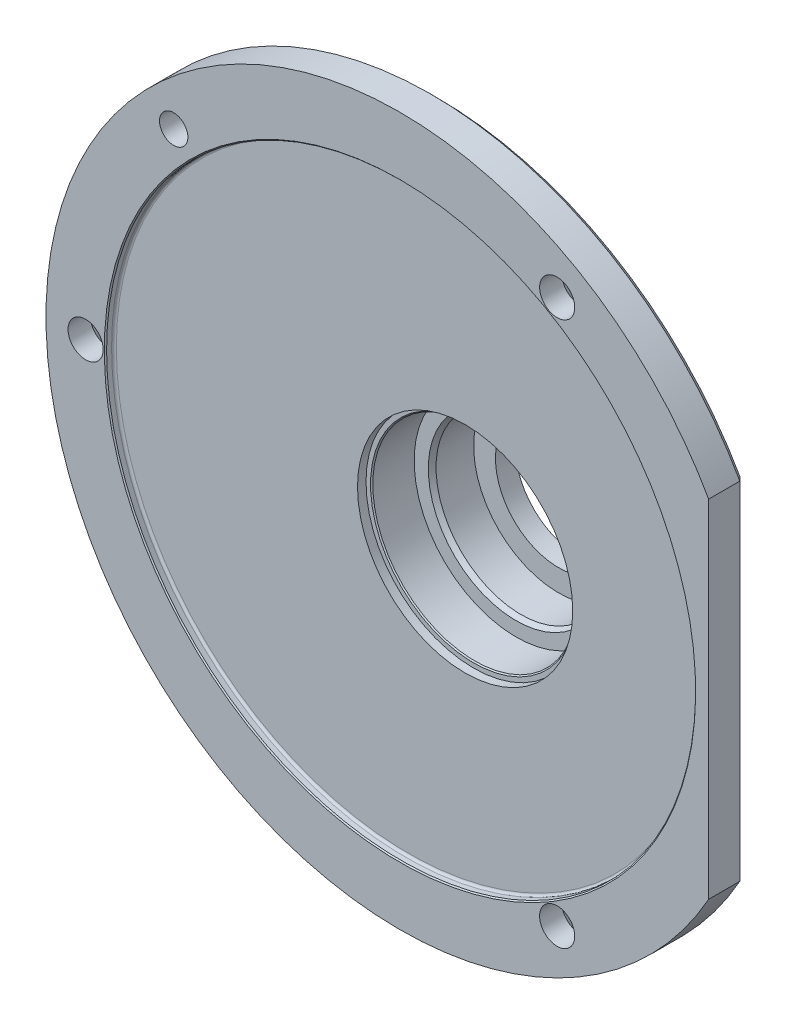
SolidWorks part; units mm, degrees
ref_plane "Plan de face" through (0, 0, 0) normal (0, 0, 1) x (1, 0, 0)
ref_plane "Plan de dessus" through (0, 0, 0) normal (0, 1, 0) x (1, 0, 0)
ref_plane "Plan de droite" through (0, 0, 0) normal (1, 0, 0) x (0, 0, -1)
sketch "Esquisse1" plane through (0, 0, 0) normal (0, 0, 1) x (1, 0, 0)
  circle A0 centre (0, 0) radius 62.5
  dimension "D1" = 125
extrude "Extrusion1" add sketch "Esquisse1" along normal blind 20
sketch "Esquisse2" plane through (0, 0, 20) normal (0, 0, 1) x (1, 0, 0)
  line L0 (0, 0) -> (10, 0) construction
  circle A0 centre (10, 0) radius 18
  dimension "D1" = 36
  dimension "D2" = 10
extrude "Enlèv. mat.-Extru.1" cut sketch "Esquisse2" against normal blind 9
sketch "Esquisse3" plane through (0, 0, 20) normal (0, 0, 1) x (1, 0, 0)
  circle A0 centre (10, 0) radius 11.1419
  circle A1 centre (10, 0) radius 18 construction
extrude "Enlèv. mat.-Extru.2" cut sketch "Esquisse3" against normal through all
sketch "Esquisse4" plane through (0, 0, 0) normal (0, 0, -1) x (-1, 0, 0)
  circle A0 centre (0, 0) radius 62.5 construction
  circle A1 centre (0, 0) radius 62.5
  circle A2 centre (-10, 0) radius 25
  circle A3 centre (-10, 0) radius 11.1419 construction
  dimension "D1" = 50
  dimension "D2" = 10
extrude "Enlèv. mat.-Extru.3" cut sketch "Esquisse4" against normal blind 15
sketch "Esquisse5" plane through (0, 0, 20) normal (0, 0, 1) x (1, 0, 0)
  circle A0 centre (10, 0) radius 19
  dimension "D1" = 38
extrude "Enlèv. mat.-Extru.4" cut sketch "Esquisse5" against normal blind 1.5
sketch "Esquisse6" plane through (0, 0, 20) normal (0, 0, 1) x (1, 0, 0)
  circle A0 centre (0, 0) radius 62.5 construction
  circle A1 centre (0, 0) radius 62.5
  circle A2 centre (0, 0) radius 52
  dimension "D1" = 104
extrude "Extrusion2" add sketch "Esquisse6" along normal blind 2
sketch "Esquisse7" plane through (0, 0, 15) normal (0, 0, -1) x (-1, 0, 0)
  line L0 (-54.5, 30.5941) -> (-54.5, -30.5941)
  circle A0 centre (0, 0) radius 62.5 construction
  arc A1 (-54.5, 30.5941) -> (-54.5, -30.5941) centre (0, 0) ccw
  dimension "D1" = 54.5
extrude "Enlèv. mat.-Extru.5" cut sketch "Esquisse7" against normal up to next
sketch "Esquisse8" plane through (0, 0, 15) normal (0, 0, -1) x (-1, 0, 0)
  circle A0 centre (55.5, 0) radius 3.1
  dimension "D1" = 6.2
  dimension "D2" = 55.5
extrude "Enlèv. mat.-Extru.6" cut sketch "Esquisse8" against normal up to next
chamfer "Chanfrein2" distance 2.55 angle 45 1 edges at (-58.6, 0, 15)
pattern_circular "Répétition circulaire1" count 3 over 360 about axis through (0, 0, 0) along (0, 0, 1) of "Chanfrein2", "Enlèv. mat.-Extru.6"
sketch "Esquisse9" plane through (54.5, 0, 0) normal (1, 0, 0) x (0, 0, -1)
  line L0 (-21.5, 62.5) -> (-21.5, -62.5)
  line L1 (-22, 62.5) -> (-22, -62.5) construction
  line L2 (-22, 62.5) -> (-22, -62.5)
  line L4 (-22, 62.5) -> (-21.5, 62.5)
  line L6 (-22, -62.5) -> (-21.5, -62.5)
  dimension "D1" = 0.5
extrude "Enlèv. mat.-Extru.7" cut sketch "Esquisse9" against normal through all
ref_plane "Plan1" through (0, 0, 0) normal (0.7071, 0.7071, 0) x (0, 0, -1)
sketch "Esquisse10" plane through (0, 0, 0) normal (0.7071, 0.7071, 0) x (0, 0, -1)
  line L0 (-35.8762, 56.5) -> (-1.7671, 56.5) construction
  line L1 (-21.5, 59) -> (-9.5, 59)
  line L2 (-9.5, 59) -> (-8.0566, 56.5)
  line L3 (-21.5, 62.5) -> (-21.5, -62.5) construction
  line L4 (-21.5, 59) -> (-21.5, 56.5)
  line L5 (-8.0566, 56.5) -> (-21.5, 56.5)
  dimension "D1" = 56.5
  dimension "D2" = 60
  dimension "D3" = 5
  dimension "D4" = 12
revolve "Enlèvement de matière-Révolution1" cut sketch "Esquisse10" angle 360 about L0
sketch "Esquisse11" plane through (0, 0, 15) normal (0, 0, -1) x (-1, 0, 0)
  line L0 (-10, 0) -> (55.5, 0) construction
  line L1 (-10, 0) -> (-27.75, 48.0644) construction
  line L2 (-10, 0) -> (-27.75, -48.0644) construction
  line L3 (-20.0595, 41.6726) -> (-13.7953, 24.7102)
  line L4 (14.4949, 5) -> (46.8397, 5)
  line L5 (-21.2219, 44.8204) -> (-7.3222, 7.1819) construction
  line L6 (14.4949, -5) -> (46.8397, -5)
  line L7 (-30.6027, 41.3561) -> (-16.703, 3.7177) construction
  line L8 (-20.0595, -41.6726) -> (-13.7953, -24.7102)
  line L9 (-29.4402, -38.2083) -> (-23.1761, -21.2459)
  line L10 (-29.4402, 38.2083) -> (-23.1761, 21.2459)
  line L11 (-22.148, -47.3279) -> (-11.4794, -18.4391) construction
  line L12 (-31.5287, -43.8637) -> (-20.8602, -14.9748) construction
  arc A0 (46.8397, 5) -> (46.8397, -5) centre (55.5, 0) ccw
  arc A1 (-29.4402, 38.2083) -> (-20.0595, 41.6726) centre (-27.75, 48.0644) ccw
  arc A2 (-20.0595, -41.6726) -> (-29.4402, -38.2083) centre (-27.75, -48.0644) ccw
  circle A3 centre (-10, 0) radius 25 construction
  arc A4 (-23.1761, -21.2459) -> (-13.7953, -24.7102) centre (-10, 0) ccw
  arc A5 (-13.7953, 24.7102) -> (-23.1761, 21.2459) centre (-10, 0) ccw
  arc A6 (14.4949, -5) -> (14.4949, 5) centre (-10, 0) ccw
  dimension "D1" = 20
  dimension "D2" = 20
  dimension "D3" = 20
  dimension "D4" = 5
  dimension "D5" = 10
  dimension "D6" = 5
  dimension "D7" = 5
  dimension "D8" = 10
  dimension "D9" = 10
extrude "Extrusion3" add sketch "Esquisse11" along normal up to surface (15 mm away)
fillet "Congé7" radius 5.5 6 edges at (13.7953, -24.7102, 7.5) (-14.4949, -5, 7.5) (-14.4949, 5, 7.5) (13.7953, 24.7102, 7.5) (23.1761, 21.2459, 7.5) (23.1761, -21.2459, 7.5)
sketch "Esquisse12" plane through (0, -5, 0) normal (0, -1, 0) x (1, 0, 0)
  line L3 (-46.8397, 0) -> (-18.6356, 0) construction
  line L5 (-46.8397, 0) -> (-13.5702, 0)
  line L6 (-46.8397, 0) -> (-46.8397, 15) construction
  line L7 (-46.8397, 0) -> (-46.8397, 15)
  line L8 (-13.5702, 0) -> (-46.8397, 15)
extrude "Enlèv. mat.-Extru.8" cut sketch "Esquisse12" against normal up to surface (10 mm away)
sketch "Esquisse13" plane through (4.1095, 1.5176, 0) normal (-0.9381, -0.3464, 0) x (0, 0, 1)
  line L0 (0, -32.0999) -> (0, -46.0412) construction
  line L1 (15, -46.0412) -> (0, -46.0412)
  line L2 (0, -27.0345) -> (0, -46.0412)
  line L3 (0, -27.0345) -> (15, -46.0412)
extrude "Enlèv. mat.-Extru.9" cut sketch "Esquisse13" against normal up to surface (10 mm away)
sketch "Esquisse14" plane through (13.4903, -4.9819, 0) normal (0.9381, -0.3464, 0) x (0, 0, -1)
  line L0 (0, 32.0999) -> (0, 46.0412) construction
  line L1 (-15, 46.0412) -> (0, 46.0412)
  line L2 (0, 27.0345) -> (0, 46.0412)
  line L6 (-15, 46.0412) -> (0, 27.0345)
extrude "Enlèv. mat.-Extru.10" cut sketch "Esquisse14" against normal up to surface (10 mm away)
fillet "Congé9" radius 5 15 edges at (17.6446, 35.1336, 15) (13.2093, 25.9836, 15) (-4.2913, 20.5124, 15) (-15.4864, 5.9909, 15) (-32.7377, 5, 15) (27.0254, 31.6693, 15) (24.4491, 21.8327, 15) (27.0254, -31.6693, 15) (24.4491, -21.8327, 15) (-32.7377, -5, 15) (-15.4864, -5.9909, 15) (-4.2913, -20.5124, 15) (13.2093, -25.9836, 15) (35, 0, 15) (17.6446, -35.1336, 15)
fillet "Congé10" radius 2 9 edges at (13.2093, -25.9836, 0) (-15.4864, -5.9909, 0) (-4.2913, -20.5124, 0) (-15.4864, 5.9909, 0) (13.2093, 25.9836, 0) (24.4491, 21.8327, 0) (24.4491, -21.8327, 0) (-4.2913, 20.5124, 0) (35, 0, 0)
sketch "Esquisse17" plane through (4.1095, -1.5176, 0) normal (0.9381, -0.3464, 0) x (0, 0, -1)
  line L2 (-3.9976, 32.0999) -> (-0.0001, 27.0347)
  line L3 (-2, 32.0999) -> (-3.9976, 32.0999)
  line L4 (-3.9976, 32.0999) -> (-0.0001, 27.0347)
  line L5 (-2, 32.0999) -> (-3.9976, 32.0999)
  spline S1 degree 3 poles (-2943.4044, -550.5763) (-84.5091, -29.4022) (5.3481, 7.8345) (-0.2591, 28.6201) (-0.331, 28.8411) (-0.4908, 29.2731) (-0.579, 29.4849) (-12.3869, 55.5983) (-118.2277, 34.0531) (2638.7281, 1454.16) knots -11.304076 -11.304076 -11.304076 -11.304076 0.25 0.25 0.375 0.375 0.5 0.5 16.016161 16.016161 16.016161 16.016161 only from (-0.0001, 27.0347) to (-2, 32.0999)
  spline S2 degree 3 poles (-0.0001, 27.0347) (-0.0037, 27.5) (-0.0791, 27.9527) (-0.2591, 28.6201) (-0.331, 28.8411) (-0.4908, 29.2731) (-0.579, 29.4849) (-1.0508, 30.5284) (-1.526, 31.3139) (-2, 32.0999) knots 0 0 0 0 0.25 0.25 0.375 0.375 0.5 0.5 1 1 1 1
  dimension "D1" = 0
extrude "Enlèv. mat.-Extru.12" cut sketch "Esquisse17" against normal through all
sketch "Esquisse18" plane through (13.4903, -4.9819, 0) normal (-0.9381, 0.3464, 0) x (0, 0, 1)
  line L2 (3.9976, 32.0999) -> (2, 32.0999)
  line L3 (0.0001, 27.0347) -> (3.9976, 32.0999)
  line L4 (3.9976, 32.0999) -> (2, 32.0999)
  line L5 (0.0001, 27.0347) -> (3.9976, 32.0999)
  spline S1 degree 3 poles (-2638.7612, 1454.1771) (118.2285, 34.0529) (12.3869, 55.5984) (0.579, 29.4849) (0.4908, 29.2731) (0.331, 28.8411) (0.2591, 28.6201) (-5.3481, 7.8347) (84.5074, -29.4015) (2943.3252, -550.5618) knots -15.016223 -15.016223 -15.016223 -15.016223 0.5 0.5 0.625 0.625 0.75 0.75 12.303969 12.303969 12.303969 12.303969 only from (2, 32.0999) to (0.0001, 27.0347)
  spline S2 degree 3 poles (2, 32.0999) (1.526, 31.3139) (1.0508, 30.5284) (0.579, 29.4849) (0.4908, 29.2731) (0.331, 28.8411) (0.2591, 28.6201) (0.0791, 27.9527) (0.0037, 27.5) (0.0001, 27.0347) knots 0 0 0 0 0.5 0.5 0.625 0.625 0.75 0.75 1 1 1 1
  dimension "D1" = 0
extrude "Enlèv. mat.-Extru.13" cut sketch "Esquisse18" against normal through all
sketch "Esquisse19" plane through (0, 5, 0) normal (0, -1, 0) x (1, 0, 0)
  line L2 (-18.6356, 2.2838) -> (-18.6356, 2)
  line L3 (-13.5705, 0.0001) -> (-18.6356, 2.2838)
  line L4 (-18.6356, 2.2838) -> (-18.6356, 2)
  line L5 (-13.5705, 0.0001) -> (-18.6356, 2.2838)
  spline S1 degree 3 poles (-1440.5617, -2638.7351) (-20.5908, 118.2247) (-42.1339, 12.387) (-16.0207, 0.579) (-15.8089, 0.4908) (-15.3769, 0.331) (-15.1559, 0.2592) (5.6297, -5.3484) (42.8687, 84.5058) (564.1168, 2943.3543) knots -15.016396 -15.016396 -15.016396 -15.016396 0.5 0.5 0.625 0.625 0.75 0.75 12.304409 12.304409 12.304409 12.304409 only from (-18.6356, 2) to (-13.5705, 0.0001)
  spline S2 degree 3 poles (-18.6356, 2) (-17.8496, 1.526) (-17.0641, 1.0508) (-16.0207, 0.579) (-15.8089, 0.4908) (-15.3769, 0.331) (-15.1559, 0.2592) (-14.4885, 0.0791) (-14.0358, 0.0038) (-13.5705, 0.0001) knots 0 0 0 0 0.5 0.5 0.625 0.625 0.75 0.75 1 1 1 1
  dimension "D1" = 0
extrude "Enlèv. mat.-Extru.14" cut sketch "Esquisse19" against normal through all
sketch "Esquisse20" plane through (0, -5, 0) normal (0, 1, 0) x (1, 0, 0)
  line L2 (-18.6356, -2.2838) -> (-13.5705, -0.0001)
  line L3 (-18.6356, -2) -> (-18.6356, -2.2838)
  line L4 (-18.6356, -2.2838) -> (-13.5705, -0.0001)
  line L5 (-18.6356, -2) -> (-18.6356, -2.2838)
  spline S1 degree 3 poles (564.1199, -2943.3712) (42.8688, -84.5062) (5.6297, 5.3484) (-15.1559, -0.2592) (-15.3769, -0.331) (-15.8089, -0.4908) (-16.0207, -0.579) (-42.134, -12.3871) (-20.5905, -118.2262) (-1440.592, 2638.7939) knots -11.304432 -11.304432 -11.304432 -11.304432 0.25 0.25 0.375 0.375 0.5 0.5 16.016506 16.016506 16.016506 16.016506 only from (-13.5705, -0.0001) to (-18.6356, -2)
  spline S2 degree 3 poles (-13.5705, -0.0001) (-14.0358, -0.0038) (-14.4885, -0.0791) (-15.1559, -0.2592) (-15.3769, -0.331) (-15.8089, -0.4908) (-16.0207, -0.579) (-17.0641, -1.0508) (-17.8496, -1.526) (-18.6356, -2) knots 0 0 0 0 0.25 0.25 0.375 0.375 0.5 0.5 1 1 1 1
  dimension "D1" = 0
extrude "Enlèv. mat.-Extru.15" cut sketch "Esquisse20" against normal through all
sketch "Esquisse21" plane through (4.1095, 1.5176, 0) normal (0.9381, 0.3464, 0) x (0, 0, -1)
  line L2 (-3.9976, -32.0999) -> (-2, -32.0999)
  line L3 (-0.0001, -27.0347) -> (-3.9976, -32.0999)
  line L4 (-3.9976, -32.0999) -> (-2, -32.0999)
  line L5 (-0.0001, -27.0347) -> (-3.9976, -32.0999)
  spline S1 degree 3 poles (2638.7612, -1454.1771) (-118.2285, -34.0529) (-12.3869, -55.5984) (-0.579, -29.4849) (-0.4908, -29.2731) (-0.331, -28.8411) (-0.2591, -28.6201) (5.3481, -7.8347) (-84.5074, 29.4015) (-2943.3252, 550.5618) knots -15.016223 -15.016223 -15.016223 -15.016223 0.5 0.5 0.625 0.625 0.75 0.75 12.303969 12.303969 12.303969 12.303969 only from (-2, -32.0999) to (-0.0001, -27.0347)
  spline S2 degree 3 poles (-2, -32.0999) (-1.526, -31.3139) (-1.0508, -30.5284) (-0.579, -29.4849) (-0.4908, -29.2731) (-0.331, -28.8411) (-0.2591, -28.6201) (-0.0791, -27.9527) (-0.0037, -27.5) (-0.0001, -27.0347) knots 0 0 0 0 0.5 0.5 0.625 0.625 0.75 0.75 1 1 1 1
  dimension "D1" = 0
extrude "Enlèv. mat.-Extru.16" cut sketch "Esquisse21" against normal through all
sketch "Esquisse22" plane through (13.4903, 4.9819, 0) normal (-0.9381, -0.3464, 0) x (0, 0, 1)
  line L2 (3.9976, -32.0999) -> (0.0001, -27.0347)
  line L3 (2, -32.0999) -> (3.9976, -32.0999)
  line L4 (3.9976, -32.0999) -> (0.0001, -27.0347)
  line L5 (2, -32.0999) -> (3.9976, -32.0999)
  spline S1 degree 3 poles (2943.4044, 550.5763) (84.5091, 29.4022) (-5.3481, -7.8345) (0.2591, -28.6201) (0.331, -28.8411) (0.4908, -29.2731) (0.579, -29.4849) (12.3869, -55.5983) (118.2277, -34.0531) (-2638.7281, -1454.16) knots -11.304076 -11.304076 -11.304076 -11.304076 0.25 0.25 0.375 0.375 0.5 0.5 16.016161 16.016161 16.016161 16.016161 only from (0.0001, -27.0347) to (2, -32.0999)
  spline S2 degree 3 poles (0.0001, -27.0347) (0.0037, -27.5) (0.0791, -27.9527) (0.2591, -28.6201) (0.331, -28.8411) (0.4908, -29.2731) (0.579, -29.4849) (1.0508, -30.5284) (1.526, -31.3139) (2, -32.0999) knots 0 0 0 0 0.25 0.25 0.375 0.375 0.5 0.5 1 1 1 1
  dimension "D1" = 0
extrude "Enlèv. mat.-Extru.17" cut sketch "Esquisse22" against normal through all
chamfer "Chanfrein3" distance 1 angle 45 1 edges at (-62.5, 0, 15)
sketch "Esquisse15" plane through (0, 0, 11) normal (0, 0, 1) x (1, 0, 0)
  circle A0 centre (10, 0) radius 15
  dimension "D1" = 30
extrude "Enlèv. mat.-Extru.11" cut sketch "Esquisse15" against normal blind 7.5
fillet "Congé5" radius 0.42 1 edges at (52, 0, 20)
chamfer "Chanfrein4" distance 0.2 angle 45 1 edges at (0, 52, 21.5)
chamfer "Chanfrein5" distance 1 angle 45 1 edges at (54.5, 0, 15)
sketch "Esquisse  ebauche balayage 1" [suppressed] plane through (3.5944, -9.7331, -13.1471) normal (0.2146, -0.5811, -0.785) x (-0.9767, -0.1277, -0.1725)
  line L0 (-21.5176, -22.5763) -> (-24.2152, -31.8821) construction
  line L1 (-19.7209, -16.3786) -> (-26.4624, -39.6338)
  line L3 (-24.5232, -14.9864) -> (-31.2647, -38.2417)
  line L5 (-14.9186, -17.7707) -> (-21.6601, -41.026)
  line L6 (-10.1163, -19.1629) -> (-16.8579, -42.4181)
  line L7 (-5.314, -20.555) -> (-12.0556, -43.8103)
  dimension "D1" = 5
  dimension "D2" = 10
  dimension "D3" = 5
sketch "Esquisse ebauche balayage 2" [suppressed] plane through (-2.2925, 0, -5.0847) normal (-0.411, 0, -0.9116) x (-0.9116, 0, 0.411)
  line L0 (17.9274, -5) -> (36.7008, -5) construction
  line L1 (12.371, -5) -> (48.8657, -5)
  line L3 (12.371, -10) -> (48.8657, -10)
  line L5 (12.371, 0) -> (48.8657, 0)
  line L6 (12.371, -5) -> (48.8657, -5)
  line L7 (12.371, 5) -> (48.8657, 5)
  line L8 (12.371, 0) -> (48.8657, 0)
  line L9 (12.371, 10) -> (48.8657, 10)
  line L10 (12.371, 5) -> (48.8657, 5)
  dimension "D1" = 5
sketch "Esquisse ebauche balayage 3" [suppressed] plane through (3.5944, 9.7331, -13.1471) normal (0.2146, 0.5811, -0.785) x (-0.9767, 0.1277, -0.1725)
  line L0 (-11.913, 25.3606) -> (-14.6107, 34.6664) construction
  line L1 (-10.1163, 19.1629) -> (-16.8579, 42.4181)
  line L3 (-5.314, 20.555) -> (-12.0556, 43.8103)
  line L5 (-14.9186, 17.7707) -> (-21.6601, 41.026)
  line L6 (-10.1163, 19.1629) -> (-16.8579, 42.4181)
  line L7 (-19.7209, 16.3786) -> (-26.4624, 39.6338)
  line L8 (-14.9186, 17.7707) -> (-21.6601, 41.026)
  line L9 (-24.5232, 14.9864) -> (-31.2647, 38.2417)
  line L10 (-19.7209, 16.3786) -> (-26.4624, 39.6338)
  dimension "D1" = 5
sketch "Esquisse finition balayage" [suppressed] plane through (-2.2925, 0, -5.0847) normal (-0.411, 0, -0.9116) x (-0.9116, 0, 0.411)
  line L0 (17.9274, -5) -> (36.7008, -5) construction
  line L1 (12.371, -5) -> (48.8657, -5)
  line L3 (12.371, -5.5) -> (48.8657, -5.5)
  line L5 (12.371, -6) -> (48.8657, -6)
  line L6 (12.371, -6.5) -> (48.8657, -6.5)
  line L7 (12.371, -7) -> (48.8657, -7)
  line L8 (12.371, -7.5) -> (48.8657, -7.5)
  line L9 (12.371, -8) -> (48.8657, -8)
  line L10 (12.371, -8.5) -> (48.8657, -8.5)
  line L11 (12.371, -9) -> (48.8657, -9)
  line L12 (12.371, -9.5) -> (48.8657, -9.5)
  line L13 (12.371, 0) -> (48.8657, 0)
  line L14 (12.371, -0.5) -> (48.8657, -0.5)
  line L15 (12.371, -1) -> (48.8657, -1)
  line L16 (12.371, -1.5) -> (48.8657, -1.5)
  line L17 (12.371, -2) -> (48.8657, -2)
  line L18 (12.371, -2.5) -> (48.8657, -2.5)
  line L19 (12.371, -3) -> (48.8657, -3)
  line L20 (12.371, -3.5) -> (48.8657, -3.5)
  line L21 (12.371, -4) -> (48.8657, -4)
  line L22 (12.371, -4.5) -> (48.8657, -4.5)
  line L23 (12.371, 5) -> (48.8657, 5)
  line L24 (12.371, 4.5) -> (48.8657, 4.5)
  line L25 (12.371, 4) -> (48.8657, 4)
  line L26 (12.371, 3.5) -> (48.8657, 3.5)
  line L27 (12.371, 3) -> (48.8657, 3)
  line L28 (12.371, 2.5) -> (48.8657, 2.5)
  line L29 (12.371, 2) -> (48.8657, 2)
  line L30 (12.371, 1.5) -> (48.8657, 1.5)
  line L31 (12.371, 1) -> (48.8657, 1)
  line L32 (12.371, 0.5) -> (48.8657, 0.5)
  line L33 (12.371, 10) -> (48.8657, 10)
  line L34 (12.371, 9.5) -> (48.8657, 9.5)
  line L35 (12.371, 9) -> (48.8657, 9)
  line L36 (12.371, 8.5) -> (48.8657, 8.5)
  line L37 (12.371, 8) -> (48.8657, 8)
  line L38 (12.371, 7.5) -> (48.8657, 7.5)
  line L39 (12.371, 7) -> (48.8657, 7)
  line L40 (12.371, 6.5) -> (48.8657, 6.5)
  line L41 (12.371, 6) -> (48.8657, 6)
  line L42 (12.371, 5.5) -> (48.8657, 5.5)
sketch "Esquisse finition balayage  1" [suppressed] plane through (3.5944, -9.7331, -13.1471) normal (0.2146, -0.5811, -0.785) x (-0.9767, -0.1277, -0.1725)
  line L0 (-21.5176, -22.5763) -> (-24.2152, -31.8821) construction
  line L1 (-19.7209, -16.3786) -> (-26.4624, -39.6338)
  line L3 (-20.2011, -16.2394) -> (-26.9427, -39.4946)
  line L5 (-20.6813, -16.1001) -> (-27.4229, -39.3554)
  line L6 (-21.1616, -15.9609) -> (-27.9031, -39.2162)
  line L7 (-21.6418, -15.8217) -> (-28.3833, -39.077)
  line L8 (-22.122, -15.6825) -> (-28.8636, -38.9378)
  line L9 (-22.6023, -15.5433) -> (-29.3438, -38.7985)
  line L10 (-23.0825, -15.4041) -> (-29.824, -38.6593)
  line L11 (-23.5627, -15.2649) -> (-30.3043, -38.5201)
  line L12 (-24.0429, -15.1256) -> (-30.7845, -38.3809)
  line L13 (-14.9186, -17.7707) -> (-21.6601, -41.026)
  line L14 (-15.3988, -17.6315) -> (-22.1404, -40.8868)
  line L15 (-15.8791, -17.4923) -> (-22.6206, -40.7475)
  line L16 (-16.3593, -17.3531) -> (-23.1008, -40.6083)
  line L17 (-16.8395, -17.2139) -> (-23.5811, -40.4691)
  line L18 (-17.3197, -17.0746) -> (-24.0613, -40.3299)
  line L19 (-17.8, -16.9354) -> (-24.5415, -40.1907)
  line L20 (-18.2802, -16.7962) -> (-25.0217, -40.0515)
  line L21 (-18.7604, -16.657) -> (-25.502, -39.9123)
  line L22 (-19.2407, -16.5178) -> (-25.9822, -39.773)
  line L23 (-10.1163, -19.1629) -> (-16.8579, -42.4181)
  line L24 (-10.5965, -19.0237) -> (-17.3381, -42.2789)
  line L25 (-11.0768, -18.8844) -> (-17.8183, -42.1397)
  line L26 (-11.557, -18.7452) -> (-18.2986, -42.0005)
  line L27 (-12.0372, -18.606) -> (-18.7788, -41.8613)
  line L28 (-12.5175, -18.4668) -> (-19.259, -41.7221)
  line L29 (-12.9977, -18.3276) -> (-19.7392, -41.5828)
  line L30 (-13.4779, -18.1884) -> (-20.2195, -41.4436)
  line L31 (-13.9581, -18.0492) -> (-20.6997, -41.3044)
  line L32 (-14.4384, -17.9099) -> (-21.1799, -41.1652)
  line L33 (-5.314, -20.555) -> (-12.0556, -43.8103)
  line L34 (-5.7943, -20.4158) -> (-12.5358, -43.6711)
  line L35 (-6.2745, -20.2766) -> (-13.016, -43.5318)
  line L36 (-6.7547, -20.1374) -> (-13.4963, -43.3926)
  line L37 (-7.235, -19.9982) -> (-13.9765, -43.2534)
  line L38 (-7.7152, -19.859) -> (-14.4567, -43.1142)
  line L39 (-8.1954, -19.7197) -> (-14.937, -42.975)
  line L40 (-8.6756, -19.5805) -> (-15.4172, -42.8358)
  line L41 (-9.1559, -19.4413) -> (-15.8974, -42.6966)
  line L42 (-9.6361, -19.3021) -> (-16.3776, -42.5573)
sketch "Esquisse finition balayage 3" [suppressed] plane through (3.5944, 9.7331, -13.1471) normal (0.2146, 0.5811, -0.785) x (-0.9767, 0.1277, -0.1725)
  line L0 (-11.913, 25.3606) -> (-14.6107, 34.6664) construction
  line L1 (-10.1163, 19.1629) -> (-16.8579, 42.4181)
  line L3 (-9.6361, 19.3021) -> (-16.3776, 42.5573)
  line L5 (-9.1559, 19.4413) -> (-15.8974, 42.6966)
  line L6 (-9.0893, 15.1636) -> (-8.9867, 15.2662)
  line L7 (-8.6756, 19.5805) -> (-15.4172, 42.8358)
  line L8 (-8.1954, 19.7197) -> (-14.937, 42.975)
  line L9 (-7.7152, 19.859) -> (-14.4567, 43.1142)
  line L10 (-7.235, 19.9982) -> (-13.9765, 43.2534)
  line L11 (-6.7547, 20.1374) -> (-13.4963, 43.3926)
  line L12 (-6.2745, 20.2766) -> (-13.016, 43.5318)
  line L13 (-5.7943, 20.4158) -> (-12.5358, 43.6711)
  line L14 (-14.9186, 17.7707) -> (-21.6601, 41.026)
  line L15 (-14.4384, 17.9099) -> (-21.1799, 41.1652)
  line L16 (-13.9581, 18.0492) -> (-20.6997, 41.3044)
  line L17 (-13.4779, 18.1884) -> (-20.2195, 41.4436)
  line L18 (-12.9977, 18.3276) -> (-19.7392, 41.5828)
  line L19 (-12.5175, 18.4668) -> (-19.259, 41.7221)
  line L20 (-12.0372, 18.606) -> (-18.7788, 41.8613)
  line L21 (-11.557, 18.7452) -> (-18.2986, 42.0005)
  line L22 (-11.0768, 18.8844) -> (-17.8183, 42.1397)
  line L23 (-10.5965, 19.0237) -> (-17.3381, 42.2789)
  line L24 (-19.7209, 16.3786) -> (-26.4624, 39.6338)
  line L25 (-19.2407, 16.5178) -> (-25.9822, 39.773)
  line L26 (-18.7604, 16.657) -> (-25.502, 39.9123)
  line L27 (-18.2802, 16.7962) -> (-25.0217, 40.0515)
  line L28 (-17.8, 16.9354) -> (-24.5415, 40.1907)
  line L29 (-17.3197, 17.0746) -> (-24.0613, 40.3299)
  line L30 (-16.8395, 17.2139) -> (-23.5811, 40.4691)
  line L31 (-16.3593, 17.3531) -> (-23.1008, 40.6083)
  line L32 (-15.8791, 17.4923) -> (-22.6206, 40.7475)
  line L33 (-15.3988, 17.6315) -> (-22.1404, 40.8868)
  line L34 (-24.5232, 14.9864) -> (-31.2647, 38.2417)
  line L35 (-24.0429, 15.1256) -> (-30.7845, 38.3809)
  line L36 (-23.5627, 15.2649) -> (-30.3043, 38.5201)
  line L37 (-23.0825, 15.4041) -> (-29.824, 38.6593)
  line L38 (-22.6023, 15.5433) -> (-29.3438, 38.7985)
  line L39 (-22.122, 15.6825) -> (-28.8636, 38.9378)
  line L40 (-21.6418, 15.8217) -> (-28.3833, 39.077)
  line L41 (-21.1616, 15.9609) -> (-27.9031, 39.2162)
  line L42 (-20.6813, 16.1001) -> (-27.4229, 39.3554)
  line L43 (-20.2011, 16.2394) -> (-26.9427, 39.4946)
sketch "Esquisse23" plane through (0, 0, 0) normal (0, 0, -1) x (-1, 0, 0)
  line L0 (2, -12) -> (9.6828, -3.7671)
  line L1 (2, -12) -> (2.5843, -0.9256)
  line L2 (4.5, 9) -> (1, 18.7222)
  line L3 (4.5, 9) -> (-4, 13)
  line L4 (2.5843, -0.9256) -> (4.0233, -5)
  line L5 (9.6828, -3.7671) -> (5.9598, -5.5)
  arc A2 (-4, 13) -> (4.0233, -5) centre (-12.6414, -1.6399) cw
  arc A3 (1, 18.7222) -> (5.9598, -5.5) centre (-7.9522, 4.2703) cw
  dimension "D11" = 17
  dimension "D15" = 17
  dimension "D1" = 40
  dimension "D2" = 45
  dimension "D3" = 12
  dimension "D4" = 12
  dimension "D5" = 2
  dimension "D6" = 9
  dimension "D7" = 14.5
  dimension "D8" = 6
  dimension "D9" = 11
  dimension "D10" = 13
  dimension "D12" = 5
  dimension "D13" = 5.5
  dimension "D14" = 12.5843
  dimension "D16" = 19.6828
  dimension "D17" = 3.7671
  dimension "D18" = 22.472
extrude "Enlèv. mat.-Extru.18" cut sketch "Esquisse23" against normal blind 0.3
chamfer "Chanfrein6" distance 0.5 angle 60 1 edges at (25, 0, 11)
chamfer "Chanfrein7" distance 0.2 angle 45 1 edges at (28, 0, 18.5)
